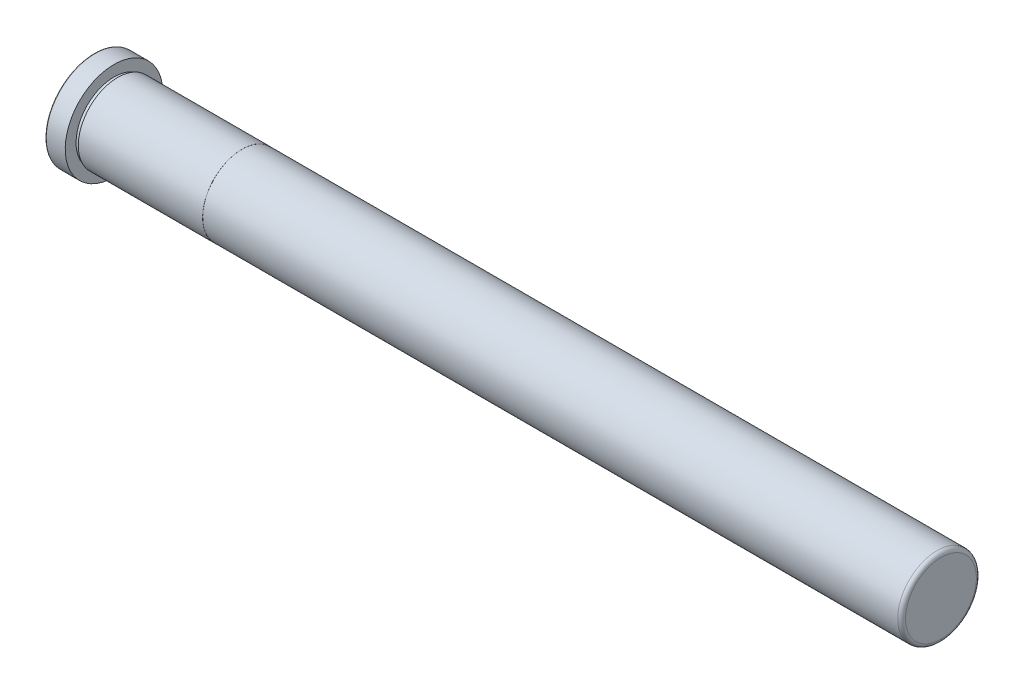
SolidWorks part; units mm, degrees
ref_plane "Front Plane" through (0, 0, 0) normal (0, 0, 1) x (1, 0, 0)
ref_plane "Top Plane" through (0, 0, 0) normal (0, 1, 0) x (1, 0, 0)
ref_plane "Right Plane" through (0, 0, 0) normal (1, 0, 0) x (0, 0, -1)
sketch "Sketch1" plane through (0, 0, 0) normal (0, 0, 1) x (1, 0, 0)
  line L0 (271.4498, 0) -> (-1.6002, 0) construction
  line L1 (-1.6002, 0) -> (-1.6002, 15.494)
  line L2 (-1.3462, 15.748) -> (4.7498, 15.748)
  line L3 (4.7498, 15.748) -> (4.7498, 12.2472)
  line L4 (4.7498, 12.2472) -> (5.9315, 12.2472)
  line L5 (5.9315, 12.2472) -> (5.9315, 12.7127)
  line L6 (46.0248, 12.7127) -> (46.0248, 12.6873)
  line L7 (46.0248, 12.6873) -> (270.1798, 12.6873)
  line L8 (271.4498, 11.4173) -> (271.4498, 0)
  line L9 (271.4498, 0) -> (-1.6002, 0)
  line L10 (271.4498, 0) -> (117.4528, 0) construction
  line L11 (-1.6002, 0) -> (-10.1781, 0) construction
  line L12 (5.9315, 12.7127) -> (46.0248, 12.7127)
  arc A0 (270.1798, 12.6873) -> (271.4498, 11.4173) centre (270.1798, 11.4173) cw
  arc A1 (-1.3462, 15.748) -> (-1.6002, 15.494) centre (-1.3462, 15.494) ccw
  point P17 (-1.6002, 15.748)
  dimension "EndRad" = 1.27
  dimension "HeadRad" = 0.254
  dimension "D1" = 0.4655
  dimension "HeadThickness" = 6.35
  dimension "OverallLength" = 273.05
  dimension "HeadDia" = 31.496
  dimension "D4" = 1.1817
  dimension "PinDia" = 25.3746
  dimension "PFL" = 47.625
  dimension "PF" = 25.4254
revolve "Revolve1" add sketch "Sketch1" angle 360 about L0
